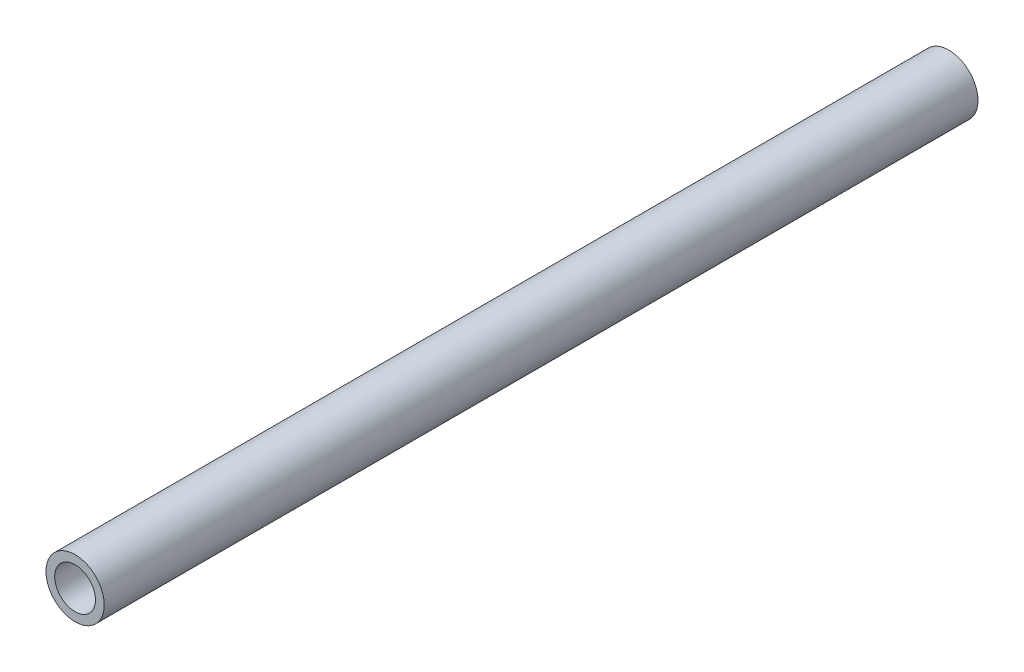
SolidWorks part; units mm, degrees
ref_plane "Ebene vorne" through (0, 0, 0) normal (0, 0, 1) x (1, 0, 0)
ref_plane "Ebene oben" through (0, 0, 0) normal (0, 1, 0) x (1, 0, 0)
ref_plane "Ebene rechts" through (0, 0, 0) normal (1, 0, 0) x (0, 0, -1)
sketch "Skizze1" plane through (0, 0, 0) normal (0, 0, 1) x (1, 0, 0)
  circle A0 centre (0, 0) radius 7
  circle A1 centre (0, 0) radius 10
  dimension "D1" = 20
  dimension "D2" = 3
extrude "Linear austragen1" add sketch "Skizze1" along normal blind 300
equation "\"LÄNGE\"=0"
equation "\"BREITE\"=0"
equation "\"HÖHE\"=0"
equation "\"DURCHMESSER\"=0"
equation "\"Stückzahl\"= 1"
